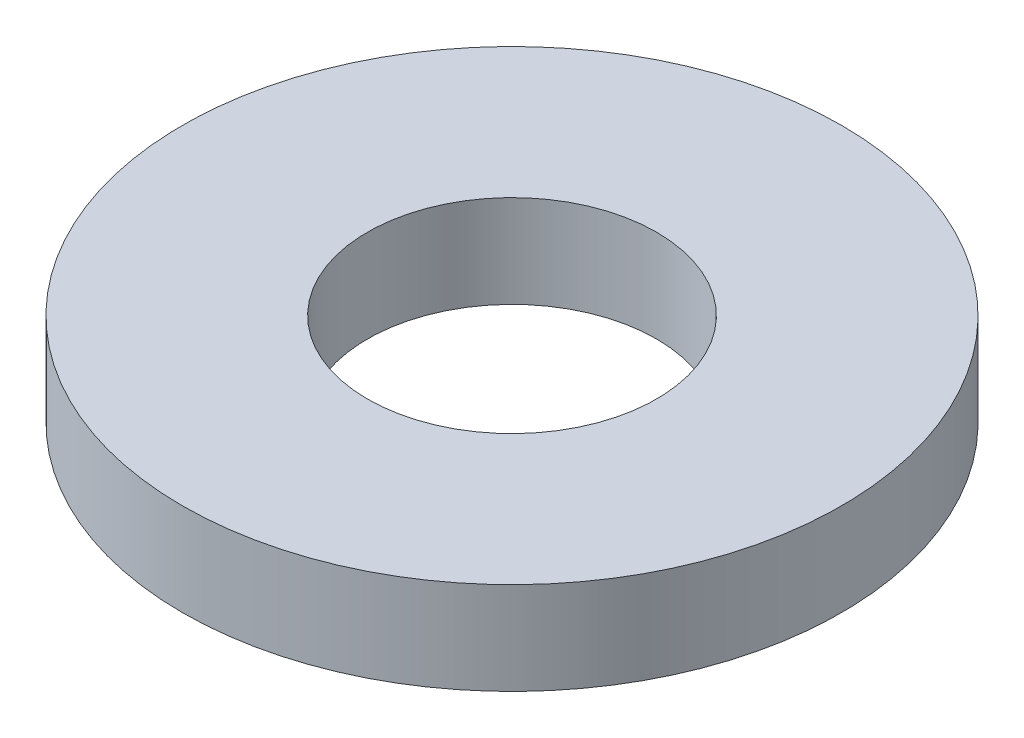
SolidWorks part; units mm, degrees
ref_plane "Front Plane" through (0, 0, 0) normal (0, 0, 1) x (1, 0, 0)
ref_plane "Top Plane" through (0, 0, 0) normal (0, 1, 0) x (1, 0, 0)
ref_plane "Right Plane" through (0, 0, 0) normal (1, 0, 0) x (0, 0, -1)
sketch "Sketch1" plane through (0, 0, 0) normal (0, 1, 0) x (1, 0, 0)
  circle A0 centre (0, 0) radius 3.9688
  circle A1 centre (0, 0) radius 9.0488
  dimension "D1" = 7.9375
  dimension "D2" = 5.08
extrude "Boss-Extrude1" add sketch "Sketch1" along normal blind 2.54
